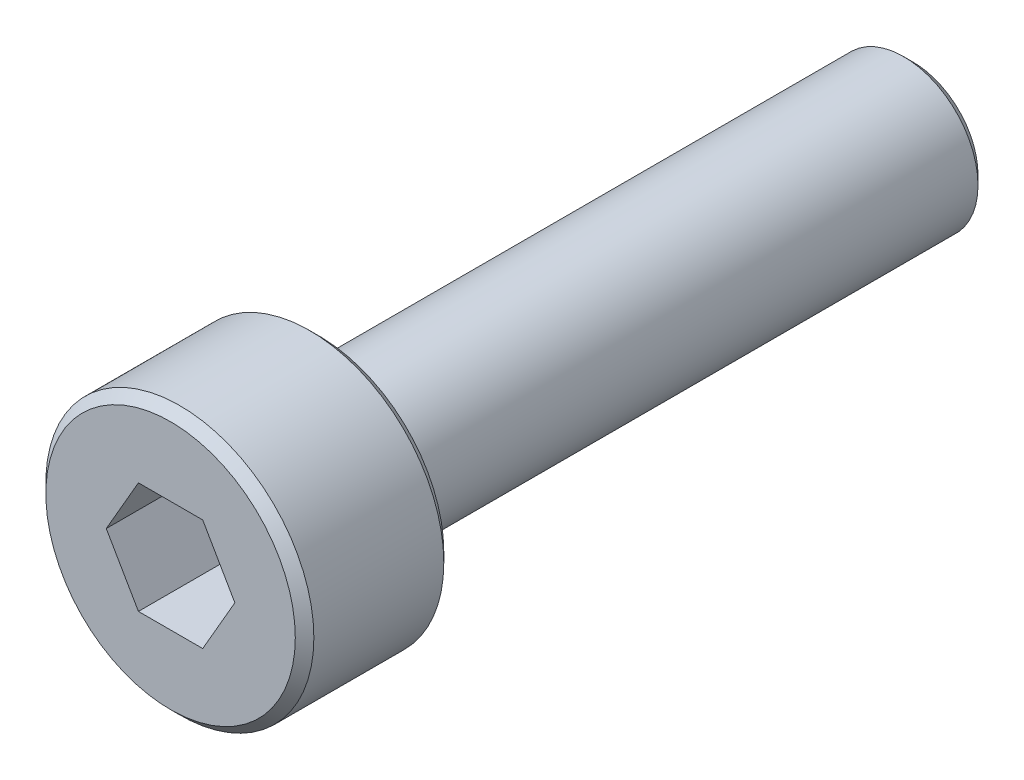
SolidWorks part; units mm, degrees
ref_plane "Front Plane" through (0, 0, 0) normal (1, 0, 0) x (0, 1, 0)
ref_plane "Top Plane" through (0, 0, 0) normal (0, 0, 1) x (0, 1, 0)
ref_plane "Right Plane" through (0, 0, 0) normal (0, 1, 0) x (-1, 0, 0)
sketch "Sketch1" plane through (0, 0, 0) normal (0, 0, 1) x (0, 1, 0)
  circle A0 centre (0, 0) radius 2
  dimension "D1" = 4
extrude "Boss-Extrude1" add sketch "Sketch1" along normal blind 16
sketch "Sketch2" plane through (0, 0, 16) normal (0, 0, 1) x (1, 0, 0)
  circle A0 centre (0, 0) radius 3.61
  dimension "D1" = 7.22
extrude "Boss-Extrude2" add sketch "Sketch2" along normal blind 4
sketch "Sketch3" plane through (0, 0, 20) normal (0, 0, 1) x (1, 0, 0)
  line L1 (1.7321, 0) -> (0.866, 1.5)
  line L2 (0.866, 1.5) -> (-0.866, 1.5)
  line L3 (-0.866, 1.5) -> (-1.7321, 0)
  line L4 (-1.7321, 0) -> (-0.866, -1.5)
  line L5 (-0.866, -1.5) -> (0.866, -1.5)
  line L6 (0.866, -1.5) -> (1.7321, 0)
  circle A0 centre (0, 0) radius 1.5 construction
  dimension "D1" = 3
extrude "Cut-Extrude1" cut sketch "Sketch3" against normal blind 2.5
chamfer "Chamfer1" distance 0.25 angle 45 3 edges at (2, 0, 0) (3.61, 0, 16) (3.61, 0, 20)
